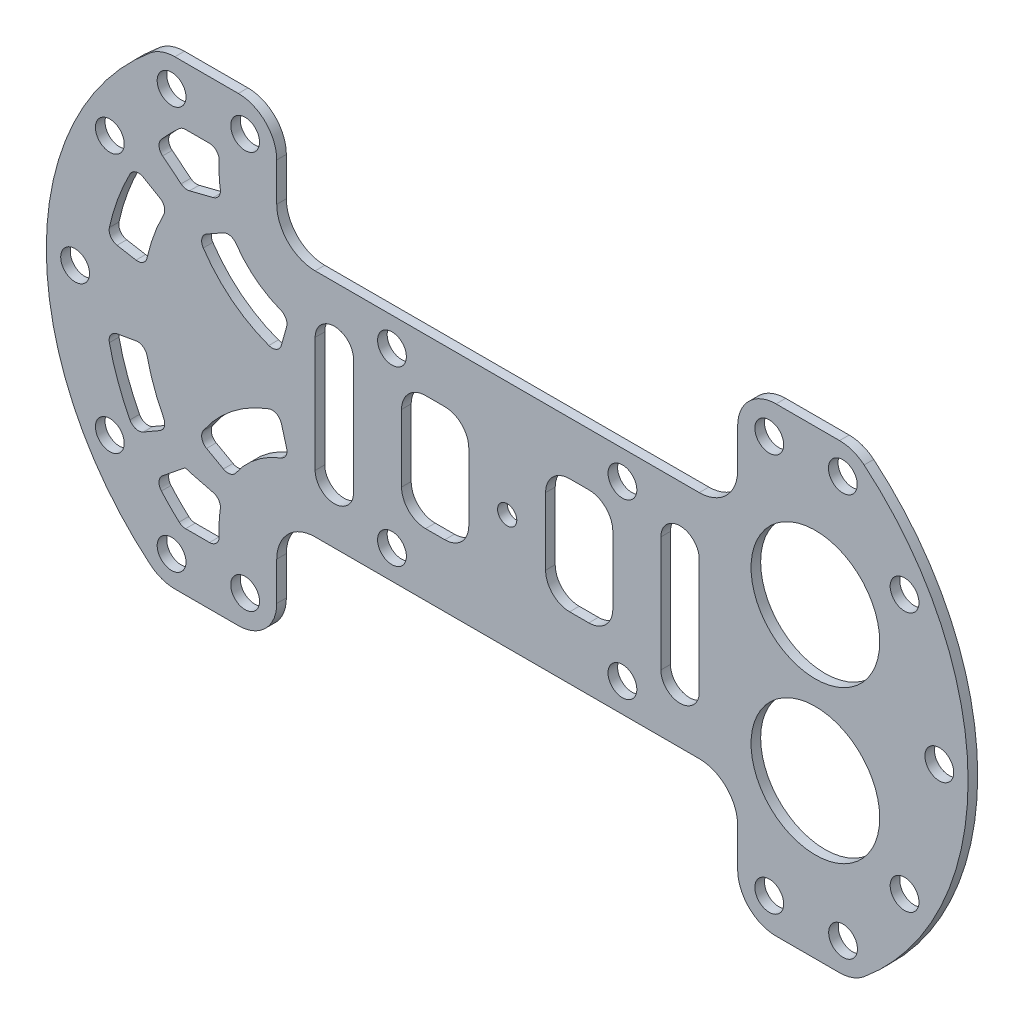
SolidWorks part; units mm, degrees
ref_plane "Front Plane" through (0, 0, 0) normal (0, 0, 1) x (1, 0, 0)
ref_plane "Top Plane" through (0, 0, 0) normal (0, 1, 0) x (1, 0, 0)
ref_plane "Right Plane" through (0, 0, 0) normal (1, 0, 0) x (0, 0, -1)
sketch "Sketch1" plane through (0, 0, 0) normal (0, 0, 1) x (1, 0, 0)
  line L0 (151.9157, 88.9) -> (151.9157, 101.6)
  line L1 (12.2157, 0) -> (139.2157, 0)
  line L3 (12.2157, 76.2) -> (139.2157, 76.2)
  line L5 (-13.1843, -38.1) -> (-34.1814, -38.1)
  line L6 (-0.4843, -25.4) -> (-0.4843, -12.7)
  line L7 (-13.1843, 114.3) -> (-34.1814, 114.3)
  line L9 (164.6157, -38.1) -> (185.6127, -38.1)
  line L10 (151.9157, -25.4) -> (151.9157, -12.7)
  line L11 (164.6157, 114.3) -> (185.6127, 114.3)
  line L13 (-0.4843, 88.9) -> (-0.4843, 101.6)
  arc A0 (193.7277, -35.1692) -> (193.7277, 111.3692) centre (132.8657, 38.1) ccw
  arc A1 (-42.2963, 111.3692) -> (-42.2963, -35.1692) centre (18.5657, 38.1) ccw
  arc A2 (164.6157, -38.1) -> (151.9157, -25.4) centre (164.6157, -25.4) cw
  arc A3 (-13.1843, -38.1) -> (-0.4843, -25.4) centre (-13.1843, -25.4) ccw
  arc A4 (-0.4843, 101.6) -> (-13.1843, 114.3) centre (-13.1843, 101.6) ccw
  arc A5 (151.9157, 101.6) -> (164.6157, 114.3) centre (164.6157, 101.6) cw
  arc A6 (193.7277, 111.3692) -> (185.6127, 114.3) centre (185.6127, 101.6) ccw
  arc A7 (193.7277, -35.1692) -> (185.6127, -38.1) centre (185.6127, -25.4) cw
  arc A8 (-42.2963, -35.1692) -> (-34.1814, -38.1) centre (-34.1814, -25.4) ccw
  arc A9 (-42.2963, 111.3692) -> (-34.1814, 114.3) centre (-34.1814, 101.6) cw
  arc A10 (12.2157, 76.2) -> (-0.4843, 88.9) centre (12.2157, 88.9) cw
  arc A11 (-0.4843, -12.7) -> (12.2157, 0) centre (12.2157, -12.7) cw
  arc A12 (151.9157, -12.7) -> (139.2157, 0) centre (139.2157, -12.7) ccw
  arc A13 (151.9157, 88.9) -> (139.2157, 76.2) centre (139.2157, 88.9) cw
  point P33 (-0.4843, 76.2)
  dimension "D1" = 12.7
  dimension "D4" = 12.7
  dimension "D5" = 12.7
  dimension "D2" = 152.4
  dimension "D3" = 76.2
  dimension "D7" = 38.1
extrude "Boss-Extrude1" add sketch "Sketch1" along normal blind 3.175
sketch "Sketch2" plane through (0, 0, 3.175) normal (0, 0, 1) x (1, 0, 0)
  line L10 (132.8657, 38.1) -> (207.1057, 80.9625) construction
  line L11 (132.8657, 38.1) -> (218.5907, 38.1) construction
  line L12 (132.8657, 38.1) -> (207.1057, -4.7625) construction
  line L13 (75.7157, 0) -> (75.7157, 76.2) construction
  line L14 (12.2157, 0) -> (139.2157, 0) construction
  line L15 (139.2157, 76.2) -> (12.2157, 76.2) construction
  line L20 (164.6157, -28.575) -> (185.6127, -28.575)
  line L21 (185.6127, 104.775) -> (164.6157, 104.775)
  line L22 (161.4407, 101.6) -> (161.4407, 88.9)
  line L23 (139.2157, 66.675) -> (12.2157, 66.675)
  line L24 (-10.0093, 88.9) -> (-10.0093, 101.6)
  line L25 (-13.1843, 104.775) -> (-34.1814, 104.775)
  line L26 (-34.1814, -28.575) -> (-13.1843, -28.575)
  line L27 (-10.0093, -25.4) -> (-10.0093, -12.7)
  line L28 (12.2157, 9.525) -> (139.2157, 9.525)
  line L29 (161.4407, -12.7) -> (161.4407, -25.4)
  line L30 (164.6157, -28.575) -> (185.6127, -28.575) construction
  line L31 (185.6127, 104.775) -> (164.6157, 104.775) construction
  line L32 (161.4407, 101.6) -> (161.4407, 88.9) construction
  line L33 (139.2157, 66.675) -> (12.2157, 66.675) construction
  line L34 (-10.0093, 88.9) -> (-10.0093, 101.6) construction
  line L35 (-13.1843, 104.775) -> (-34.1814, 104.775) construction
  line L36 (-34.1814, -28.575) -> (-13.1843, -28.575) construction
  line L37 (-10.0093, -25.4) -> (-10.0093, -12.7) construction
  line L38 (12.2157, 9.525) -> (139.2157, 9.525) construction
  line L39 (161.4407, -12.7) -> (161.4407, -25.4) construction
  circle A18 centre (207.1057, 80.9625) radius 4.7625
  circle A19 centre (218.5907, 38.1) radius 4.7625
  circle A20 centre (207.1057, -4.7625) radius 4.7625
  circle A21 centre (113.8157, 9.525) radius 4.7625
  circle A22 centre (37.6157, 9.525) radius 4.7625
  circle A23 centre (37.6157, 66.675) radius 4.7625
  circle A24 centre (113.8157, 66.675) radius 4.7625
  circle A25 centre (-55.6743, 80.9625) radius 4.7625
  circle A26 centre (-67.1593, 38.1) radius 4.7625
  circle A27 centre (-55.6743, -4.7625) radius 4.7625
  circle A30 centre (-10.9393, 103.8451) radius 4.7625
  circle A31 centre (-35.2599, 104.5862) radius 4.7625
  arc A32 (187.6415, -27.8423) -> (187.6415, 104.0423) centre (132.8657, 38.1) ccw
  arc A33 (139.2157, 66.675) -> (161.4407, 88.9) centre (139.2157, 88.9) ccw
  arc A34 (-10.0093, 88.9) -> (12.2157, 66.675) centre (12.2157, 88.9) ccw
  arc A35 (-36.2101, 104.0423) -> (-36.2101, -27.8423) centre (18.5657, 38.1) ccw
  arc A36 (12.2157, 9.525) -> (-10.0093, -12.7) centre (12.2157, -12.7) ccw
  arc A37 (161.4407, -12.7) -> (139.2157, 9.525) centre (139.2157, -12.7) ccw
  arc A38 (187.6415, -27.8423) -> (187.6415, 104.0423) centre (132.8657, 38.1) ccw construction
  arc A39 (139.2157, 66.675) -> (161.4407, 88.9) centre (139.2157, 88.9) ccw construction
  arc A40 (-10.0093, 88.9) -> (12.2157, 66.675) centre (12.2157, 88.9) ccw construction
  arc A41 (-36.2101, 104.0423) -> (-36.2101, -27.8423) centre (18.5657, 38.1) ccw construction
  arc A42 (12.2157, 9.525) -> (-10.0093, -12.7) centre (12.2157, -12.7) ccw construction
  arc A43 (161.4407, -12.7) -> (139.2157, 9.525) centre (139.2157, -12.7) ccw construction
  circle A44 centre (-10.9393, -27.6451) radius 4.7625
  circle A45 centre (-35.2599, -28.575) radius 4.7625
  circle A46 centre (162.3706, -27.6451) radius 4.7625
  circle A47 centre (186.7663, -28.358) radius 4.7625
  circle A48 centre (162.3706, 103.8451) radius 4.7625
  circle A49 centre (186.6912, 104.5862) radius 4.7625
  arc A56 (161.4407, -25.4) -> (164.6157, -28.575) centre (164.6157, -25.4) ccw
  arc A57 (161.4407, -25.4) -> (164.6157, -28.575) centre (164.6157, -25.4) ccw construction
  arc A58 (185.6127, -28.575) -> (187.6415, -27.8423) centre (185.6127, -25.4) ccw
  arc A59 (185.6127, -28.575) -> (187.6415, -27.8423) centre (185.6127, -25.4) ccw construction
  arc A60 (187.6415, 104.0423) -> (185.6127, 104.775) centre (185.6127, 101.6) ccw
  arc A61 (187.6415, 104.0423) -> (185.6127, 104.775) centre (185.6127, 101.6) ccw construction
  arc A62 (164.6157, 104.775) -> (161.4407, 101.6) centre (164.6157, 101.6) ccw
  arc A63 (164.6157, 104.775) -> (161.4407, 101.6) centre (164.6157, 101.6) ccw construction
  arc A64 (-10.0093, 101.6) -> (-13.1843, 104.775) centre (-13.1843, 101.6) ccw
  arc A65 (-10.0093, 101.6) -> (-13.1843, 104.775) centre (-13.1843, 101.6) ccw construction
  arc A66 (-34.1814, 104.775) -> (-36.2101, 104.0423) centre (-34.1814, 101.6) ccw
  arc A67 (-34.1814, 104.775) -> (-36.2101, 104.0423) centre (-34.1814, 101.6) ccw construction
  arc A68 (-36.2101, -27.8423) -> (-34.1814, -28.575) centre (-34.1814, -25.4) ccw
  arc A69 (-36.2101, -27.8423) -> (-34.1814, -28.575) centre (-34.1814, -25.4) ccw construction
  arc A70 (-13.1843, -28.575) -> (-10.0093, -25.4) centre (-13.1843, -25.4) ccw
  arc A71 (-13.1843, -28.575) -> (-10.0093, -25.4) centre (-13.1843, -25.4) ccw construction
  dimension "D2" = 9.525
  dimension "D6" = 38.1
  dimension "D7" = 38.1
  dimension "D3" = 30
  dimension "D4" = 30
  dimension "D1" = 9.525
extrude "Cut-Extrude1" cut sketch "Sketch2" against normal blind 12.7
sketch "Sketch3" plane through (0, 0, 3.175) normal (0, 0, 1) x (1, 0, 0)
  line L0 (18.5657, 57.15) -> (18.5657, 19.05) construction
  line L3 (-30.8666, 77.9585) -> (-40.7531, 85.9302) construction
  line L4 (12.2157, 88.9) -> (-30.8666, 77.9585) construction
  line L5 (12.2157, 88.9) -> (0.1502, 46.1189) construction
  line L6 (12.2157, 88.9) -> (-26.5668, 67.1808) construction
  line L7 (12.2157, 88.9) -> (-10.5113, 50.6994) construction
  line L8 (-32.1024, 78.9549) -> (-38.2277, 83.8939)
  line L9 (-21.4945, 80.3387) -> (-29.328, 78.3492)
  line L10 (-18.1301, 71.9055) -> (-23.6899, 68.7919)
  line L11 (2.7749, 55.4254) -> (1.0452, 49.2924)
  line L12 (-39.1111, 71.3997) -> (-44.616, 74.578)
  line L13 (-47.0219, 49.6649) -> (-53.2819, 50.7687)
  line L14 (-19.5343, 88.9) -> (-19.5343, 95.25) construction
  line L15 (-19.5343, 95.25) -> (-31.8359, 95.25) construction
  line L16 (2.7749, 20.7746) -> (1.0452, 26.9076)
  line L17 (-18.1301, 4.2945) -> (-23.6899, 7.4081)
  line L18 (-22.7093, -19.05) -> (-30.6212, -19.05)
  line L19 (-19.5343, -12.7) -> (-19.5343, -15.875)
  line L22 (88.4157, 50.8) -> (88.4157, 28.575)
  line L23 (75.7157, 0) -> (75.7157, 86.6401) construction
  line L24 (48.7282, 58.7375) -> (55.0782, 58.7375)
  line L25 (12.2157, 0) -> (139.2157, 0) construction
  line L26 (96.3532, 20.6375) -> (102.7032, 20.6375)
  line L28 (110.6407, 50.8) -> (110.6407, 28.575)
  line L30 (170.9657, -19.05) -> (183.2672, -19.05)
  line L31 (183.2672, 95.25) -> (170.9657, 95.25)
  line L32 (170.9657, 95.25) -> (170.9657, 88.9)
  line L33 (139.2157, 57.15) -> (12.2157, 57.15)
  line L34 (-19.5343, 88.9) -> (-19.5343, 95.25)
  line L35 (-19.5343, 95.25) -> (-31.8359, 95.25)
  line L36 (-31.8359, -19.05) -> (-19.5343, -19.05)
  line L37 (-19.5343, -19.05) -> (-19.5343, -12.7)
  line L38 (12.2157, 19.05) -> (139.2157, 19.05)
  line L39 (170.9657, -12.7) -> (170.9657, -19.05)
  line L44 (-19.5343, 88.9) -> (-19.5343, 92.075)
  line L45 (-22.7093, 95.25) -> (-30.6212, 95.25)
  line L53 (102.7032, 58.7375) -> (96.3532, 58.7375)
  line L56 (40.7907, 50.8) -> (40.7907, 28.575)
  line L57 (55.0782, 20.6375) -> (48.7282, 20.6375)
  line L58 (63.0157, 50.8) -> (63.0157, 28.575)
  line L60 (-21.4945, -4.1387) -> (-29.328, -2.1492)
  line L61 (-30.8666, -1.7585) -> (-38.2277, -7.6939)
  line L62 (135.5275, 38.1) -> (207.1057, 80.9625) construction
  line L63 (135.5275, 38.1) -> (207.1057, -4.7625) construction
  line L64 (-31.8359, -19.05) -> (-19.5343, -19.05) construction
  line L65 (-19.5343, -19.05) -> (-19.5343, -12.7) construction
  line L66 (-30.8666, -1.7585) -> (-30.8666, -1.7585) construction
  line L67 (-30.8666, -1.7585) -> (-30.8666, -1.7585) construction
  line L68 (-47.0219, 26.5351) -> (-53.2819, 25.4313)
  line L69 (-39.1111, 4.8003) -> (-44.616, 1.622)
  line L70 (132.8657, 57.15) -> (132.8657, 19.05) construction
  line L87 (139.2157, 57.15) -> (139.2157, 19.05)
  line L88 (126.5157, 57.15) -> (126.5157, 19.05)
  line L89 (24.9157, 57.15) -> (24.9157, 19.05)
  line L90 (12.2157, 57.15) -> (12.2157, 19.05)
  line L91 (139.2157, 76.2) -> (12.2157, 76.2) construction
  line L97 (-30.8666, 77.9585) -> (-30.8666, 77.9585) construction
  line L98 (-30.8666, 77.9585) -> (-30.8666, 77.9585) construction
  arc A0 (-49.0196, 73.2948) -> (-55.8304, 54.5822) centre (18.5657, 38.1) ccw
  arc A1 (-31.8359, 95.25) -> (-31.8359, -19.05) centre (18.5657, 38.1) ccw construction
  arc A2 (-30.8666, 77.9585) -> (-30.8666, -1.7585) centre (18.5657, 38.1) ccw construction
  arc A3 (-30.8666, 77.9585) -> (12.2157, 44.45) centre (12.2157, 88.9) ccw construction
  arc A4 (-13.961, 70.9322) -> (0.8552, 59.2521) centre (12.2157, 88.9) ccw
  arc A5 (-19.5343, 88.9) -> (12.2157, 57.15) centre (12.2157, 88.9) ccw construction
  arc A6 (-44.616, 74.578) -> (-49.0196, 73.2948) centre (-46.2035, 71.8283) ccw
  arc A7 (-37.8765, 67.1953) -> (-39.1111, 71.3997) centre (-40.6986, 68.6501) ccw
  arc A8 (-43.3736, 52.092) -> (-47.0219, 49.6649) centre (-46.4706, 52.7916) cw
  arc A9 (-53.2819, 50.7687) -> (-55.8304, 54.5822) centre (-52.7306, 53.8954) cw
  arc A11 (-19.1405, 83.9145) -> (-21.4945, 80.3387) centre (-22.2761, 83.416) cw
  arc A12 (-19.5343, 92.075) -> (-22.7093, 95.25) centre (-22.7093, 92.075) ccw
  arc A13 (-30.6212, 95.25) -> (-32.7598, 94.4217) centre (-30.6212, 92.075) ccw
  arc A14 (-38.2277, 83.8939) -> (-38.6174, 88.464) centre (-36.2348, 86.3655) cw
  arc A15 (-3.1049, 47.1737) -> (1.0452, 49.2924) centre (-2.0106, 50.1542) ccw
  arc A16 (2.7749, 55.4254) -> (0.8552, 59.2521) centre (-0.2809, 56.2873) ccw
  arc A17 (-13.961, 70.9322) -> (-18.1301, 71.9055) centre (-16.5787, 69.1354) ccw
  arc A18 (-23.6899, 68.7919) -> (-24.7811, 64.2619) centre (-22.1385, 66.0217) ccw
  arc A19 (-24.7811, 11.9381) -> (-3.1049, 29.0263) centre (12.2157, -12.7) cw
  arc A20 (-23.6899, 7.4081) -> (-24.7811, 11.9381) centre (-22.1385, 10.1783) cw
  arc A21 (-13.961, 5.2678) -> (-18.1301, 4.2945) centre (-16.5787, 7.0646) cw
  arc A22 (2.7749, 20.7746) -> (0.8552, 16.9479) centre (-0.2809, 19.9127) cw
  arc A23 (-3.1049, 29.0263) -> (1.0452, 26.9076) centre (-2.0106, 26.0458) cw
  arc A24 (-13.961, 5.2678) -> (0.8552, 16.9479) centre (12.2157, -12.7) cw
  arc A25 (-32.7598, -18.2217) -> (-38.6174, -12.264) centre (18.5657, 38.1) cw
  arc A26 (-19.5343, -12.7) -> (-19.1405, -7.7145) centre (12.2157, -12.7) cw
  arc A27 (-38.2277, -7.6939) -> (-38.6174, -12.264) centre (-36.2348, -10.1655) ccw
  arc A42 (183.2672, -19.05) -> (183.2672, 95.25) centre (132.8657, 38.1) ccw
  arc A43 (139.2157, 57.15) -> (170.9657, 88.9) centre (139.2157, 88.9) ccw
  arc A44 (-19.5343, 88.9) -> (12.2157, 57.15) centre (12.2157, 88.9) ccw
  arc A45 (-31.8359, 95.25) -> (-31.8359, -19.05) centre (18.5657, 38.1) ccw
  arc A46 (12.2157, 19.05) -> (-19.5343, -12.7) centre (12.2157, -12.7) ccw
  arc A47 (170.9657, -12.7) -> (139.2157, 19.05) centre (139.2157, -12.7) ccw
  arc A50 (-19.5343, 88.9) -> (-19.1405, 83.9145) centre (12.2157, 88.9) ccw
  arc A51 (-32.7598, 94.4217) -> (-38.6174, 88.464) centre (18.5657, 38.1) ccw
  arc A56 (-30.6212, -19.05) -> (-32.7598, -18.2217) centre (-30.6212, -15.875) cw
  arc A57 (-37.8765, 67.1953) -> (-43.3736, 52.092) centre (18.5657, 38.1) ccw
  arc A58 (-24.7811, 64.2619) -> (-3.1049, 47.1737) centre (12.2157, 88.9) ccw
  arc A59 (12.2157, 31.75) -> (-30.8666, -1.7585) centre (12.2157, -12.7) ccw construction
  arc A60 (12.2157, 19.05) -> (-19.5343, -12.7) centre (12.2157, -12.7) ccw construction
  arc A61 (-19.5343, -15.875) -> (-22.7093, -19.05) centre (-22.7093, -15.875) cw
  arc A62 (-19.1405, -7.7145) -> (-21.4945, -4.1387) centre (-22.2761, -7.216) ccw
  arc A63 (-30.8666, -1.7585) -> (-29.328, -2.1492) centre (-30.854, -4.9334) cw
  arc A64 (-37.8765, 9.0047) -> (-43.3736, 24.108) centre (18.5657, 38.1) cw
  arc A65 (-53.2819, 25.4313) -> (-55.8304, 21.6178) centre (-52.7306, 22.3046) ccw
  arc A66 (-43.3736, 24.108) -> (-47.0219, 26.5351) centre (-46.4706, 23.4084) ccw
  arc A67 (-37.8765, 9.0047) -> (-39.1111, 4.8003) centre (-40.6986, 7.5499) cw
  arc A68 (-44.616, 1.622) -> (-49.0196, 2.9052) centre (-46.2035, 4.3717) cw
  arc A69 (-49.0196, 2.9052) -> (-55.8304, 21.6178) centre (18.5657, 38.1) cw
  arc A108 (-29.328, 78.3492) -> (-32.1024, 78.9549) centre (-30.1095, 81.4265) cw
  circle A109 centre (177.6184, 12.8951) radius 21.2725
  circle A110 centre (177.6184, 63.3049) radius 21.2725
  arc A111 (88.4157, 28.575) -> (96.3532, 20.6375) centre (96.3532, 28.575) ccw
  arc A112 (102.7032, 20.6375) -> (110.6407, 28.575) centre (102.7032, 28.575) ccw
  arc A113 (102.7032, 58.7375) -> (110.6407, 50.8) centre (102.7032, 50.8) cw
  arc A114 (88.4157, 50.8) -> (96.3532, 58.7375) centre (96.3532, 50.8) cw
  arc A115 (48.7282, 58.7375) -> (40.7907, 50.8) centre (48.7282, 50.8) ccw
  arc A116 (55.0782, 58.7375) -> (63.0157, 50.8) centre (55.0782, 50.8) cw
  arc A117 (55.0782, 20.6375) -> (63.0157, 28.575) centre (55.0782, 28.575) ccw
  arc A118 (40.7907, 28.575) -> (48.7282, 20.6375) centre (48.7282, 28.575) ccw
  arc A121 (139.2157, 57.15) -> (126.5157, 57.15) centre (132.8657, 57.15) ccw
  arc A122 (126.5157, 19.05) -> (139.2157, 19.05) centre (132.8657, 19.05) ccw
  arc A123 (24.9157, 57.15) -> (12.2157, 57.15) centre (18.5657, 57.15) ccw
  arc A124 (12.2157, 19.05) -> (24.9157, 19.05) centre (18.5657, 19.05) ccw
  point P9 (18.5657, 38.1)
  point P15 (88.4157, 20.6375)
  point P21 (110.6407, 58.7375)
  point P27 (132.8657, 38.1)
  point P106 (-36.4269, 69.85)
  point P109 (-43.9696, 49.1267)
  point P118 (-18.5574, 81.0846)
  point P133 (3.5975, 58.342)
  point P136 (-15.4861, 73.3863)
  point P151 (-15.4861, 2.8137)
  point P152 (3.5975, 17.858)
  point P168 (-18.5574, -4.8846)
  point P181 (-43.9696, 27.0733)
  point P182 (-36.4269, 6.35)
  point P237 (147.8339, 17.858)
  point P239 (147.8339, 58.342)
  dimension "D6" = 7.9375
  dimension "D7" = 57.15
  dimension "D13" = 3.175
  dimension "D14" = 3.175
  dimension "D15" = 38.1
  dimension "D16" = 3.175
  dimension "D5" = 42.545
  dimension "D17" = 42.545
  dimension "D2" = 12.7
  dimension "D3" = 12.7
  dimension "D4" = 57.15
  dimension "D8" = 38.1
  dimension "D9" = 38.1
  dimension "D10" = 15
  dimension "D11" = 60
  dimension "D12" = 38.1
  dimension "D18" = 12.7
  dimension "D19" = 12.7
  dimension "D20" = 22.225
  dimension "D21" = 38.1
  dimension "D22" = 22.225
  dimension "D23" = 38.1
  dimension "D24" = 12.7
  dimension "D25" = 12.7
  dimension "D1" = 19.05
extrude "Cut-Extrude2" cut sketch "Sketch3" against normal blind 12.7
sketch "Sketch4" plane through (0, 0, 3.175) normal (0, 0, 1) x (1, 0, 0)
  line L0 (12.2157, 0) -> (139.2157, 0) construction
  line L1 (63.0157, 28.575) -> (63.0157, 50.8) construction
  circle A0 centre (75.7157, 38.1) radius 3.175
  dimension "D1" = 6.35
  dimension "D2" = 38.1
  dimension "D3" = 12.7
extrude "Cut-Extrude3" cut sketch "Sketch4" against normal through all
